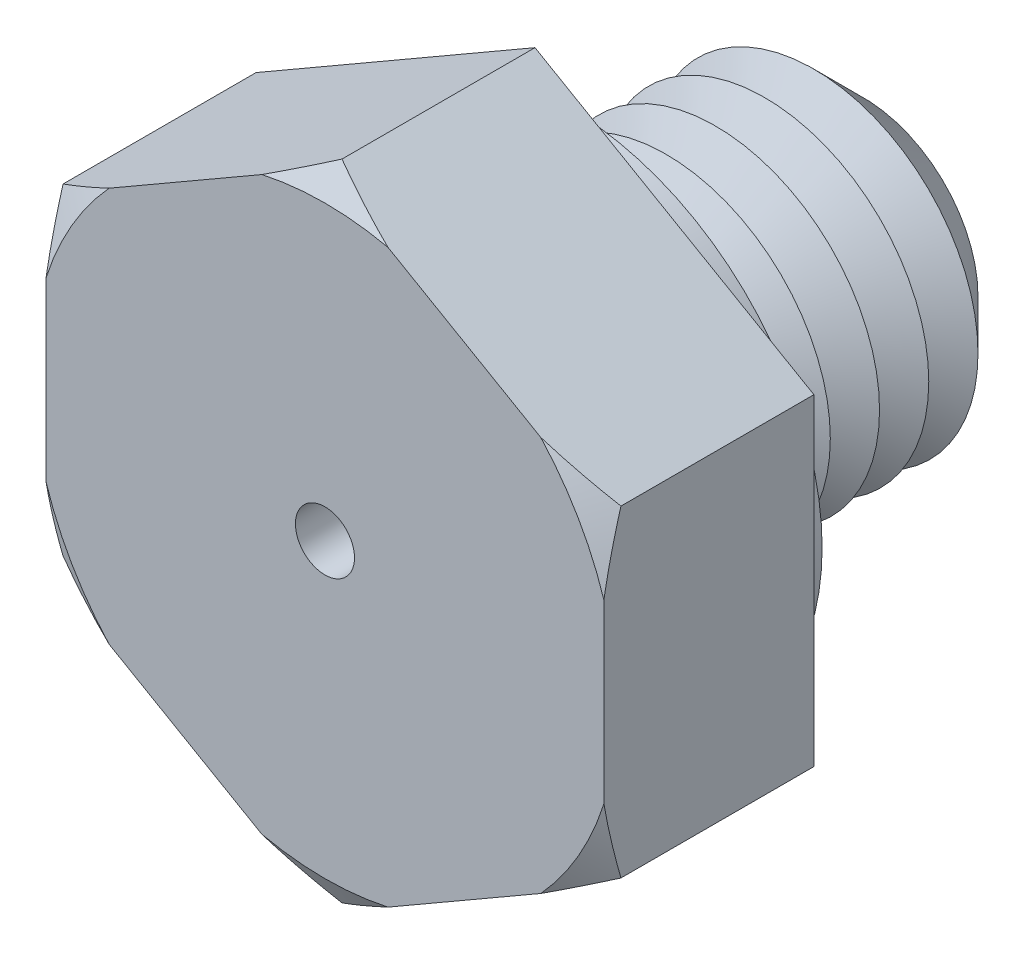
SolidWorks part; units mm, degrees
ref_plane "Front Plane" through (0, 0, 0) normal (0, 0, 1) x (1, 0, 0)
ref_plane "Top Plane" through (0, 0, 0) normal (0, 1, 0) x (1, 0, 0)
ref_plane "Right Plane" through (0, 0, 0) normal (1, 0, 0) x (0, 0, -1)
sketch "Sketch2" plane through (0, 0, 0) normal (0, 0, 1) x (1, 0, 0)
  line L1 (0, 9.815) -> (-8.5, 4.9075)
  line L2 (-8.5, 4.9075) -> (-8.5, -4.9075)
  line L3 (-8.5, -4.9075) -> (0, -9.815)
  line L4 (0, -9.815) -> (8.5, -4.9075)
  line L5 (8.5, -4.9075) -> (8.5, 4.9075)
  line L6 (8.5, 4.9075) -> (0, 9.815)
  circle A0 centre (0, 0) radius 8.5 construction
  dimension "D1" = 17
extrude "Boss-Extrude1" add sketch "Sketch2" along normal blind 6.4
sketch "Sketch3" plane through (0, 0, 0) normal (0, 0, -1) x (-1, 0, 0)
  circle A0 centre (0, 0) radius 5
  dimension "D1" = 10
extrude "Boss-Extrude2" add sketch "Sketch3" along normal blind 10
sketch "Sketch4" plane through (0, 0, 0) normal (0, 0, -1) x (-1, 0, 0)
  circle A0 centre (0, 0) radius 7.75
  dimension "D1" = 15.5
extrude "Boss-Extrude3" add sketch "Sketch4" along normal blind 1
sketch "Sketch5" plane through (0, 0, 0) normal (1, 0, 0) x (0, 0, -1)
  line L0 (-3.2117, 0) -> (6.3192, 0) construction
chamfer "Chamfer1" distance 1.5 angle 45 1 edges at (-5, 0, -10)
sketch "Sketch6" plane through (0, 0, 0) normal (1, 0, 0) x (0, 0, -1)
  line L0 (1, 5) -> (1.75, 3.701)
  line L1 (1.75, 3.701) -> (2.5, 5)
  line L2 (8.5, 5) -> (1, 5) construction
  line L3 (2.5, 5) -> (1, 5)
  dimension "D1" = 1.5
revolve "Cut-Revolve1" cut sketch "Sketch6" angle 360 about L0
pattern_linear "LPattern1" count 5 spacing 1.5 along (0, 0, -1) of "Cut-Revolve1"
sketch "Sketch7" plane through (0, 0, 0) normal (1, 0, 0) x (0, 0, -1)
  line L0 (-6.4, 9.815) -> (-6.4, 8.915)
  line L1 (-6.4, 4.9075) -> (-6.4, 9.815) construction
  line L2 (-6.4, 8.915) -> (-5.8804, 9.815)
  line L3 (-6.4, 9.815) -> (0, 9.815) construction
  line L4 (-5.8804, 9.815) -> (-6.4, 9.815)
  dimension "D1" = 0.9
  dimension "D2" = 30
revolve "Cut-Revolve2" cut sketch "Sketch7" angle 360 about L0
sketch "Sketch8" plane through (0, 0, 6.4) normal (0, 0, 1) x (1, 0, 0)
  circle A0 centre (0, 0) radius 0.9
  dimension "D1" = 1.8
extrude "Cut-Extrude1" cut sketch "Sketch8" against normal up to surface (16.4 mm away)
